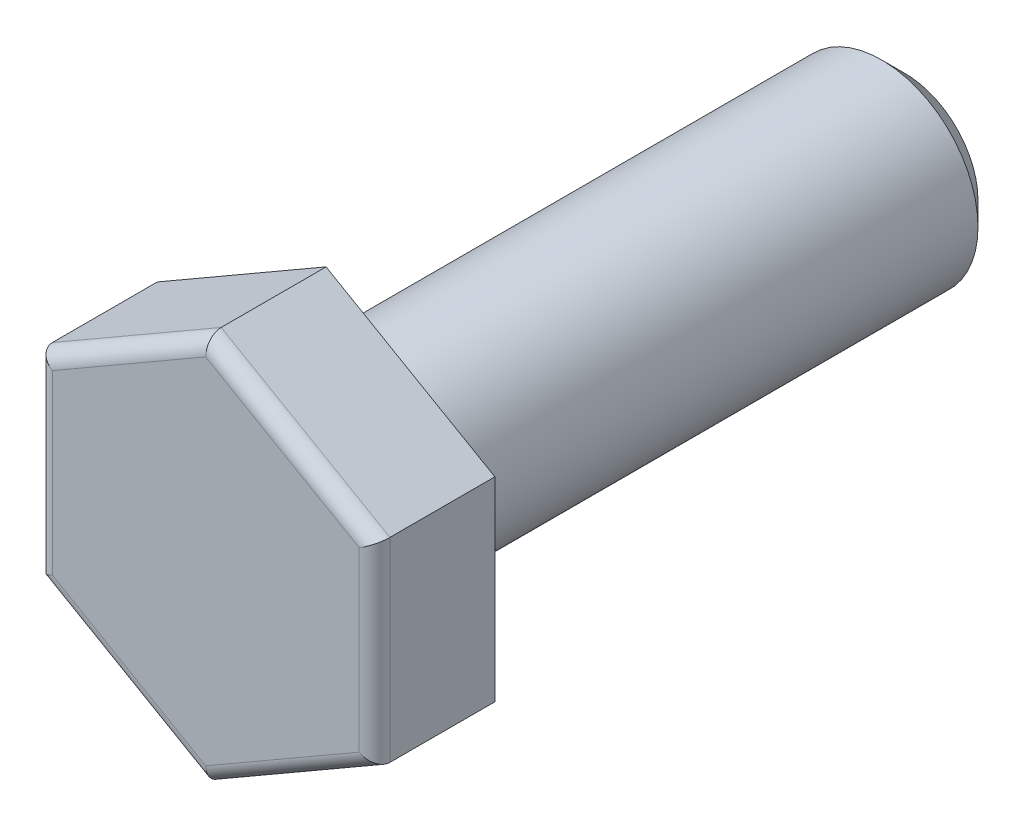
SolidWorks part; units mm, degrees
ref_plane "Front" through (0, 0, 0) normal (0, 0, 1) x (1, 0, 0)
ref_plane "Top" through (0, 0, 0) normal (0, 1, 0) x (1, 0, 0)
ref_plane "Right" through (0, 0, 0) normal (1, 0, 0) x (0, 0, -1)
sketch "Sketch1" plane through (0, 0, 0) normal (0, 0, 1) x (1, 0, 0)
  line L1 (5.5562, 3.2079) -> (0, 6.4158)
  line L2 (0, 6.4158) -> (-5.5562, 3.2079)
  line L3 (-5.5562, 3.2079) -> (-5.5562, -3.2079)
  line L4 (-5.5562, -3.2079) -> (0, -6.4158)
  line L5 (0, -6.4158) -> (5.5563, -3.2079)
  line L6 (5.5563, -3.2079) -> (5.5562, 3.2079)
  circle A0 centre (0, 0) radius 5.5562 construction
  dimension "D1" = 11.1125
extrude "HEAD" add sketch "Sketch1" along normal blind 3.9624
sketch "Sketch2" plane through (0, 0, 0) normal (0, 0, -1) x (-1, 0, 0)
  circle A0 centre (0, 0) radius 3.175
  dimension "D1" = 6.35
extrude "Boss-Extrude1" add sketch "Sketch2" along normal blind 19.05
chamfer "Chamfer1" distance 0.762 angle 45
fillet "Fillet1" radius 0.508
